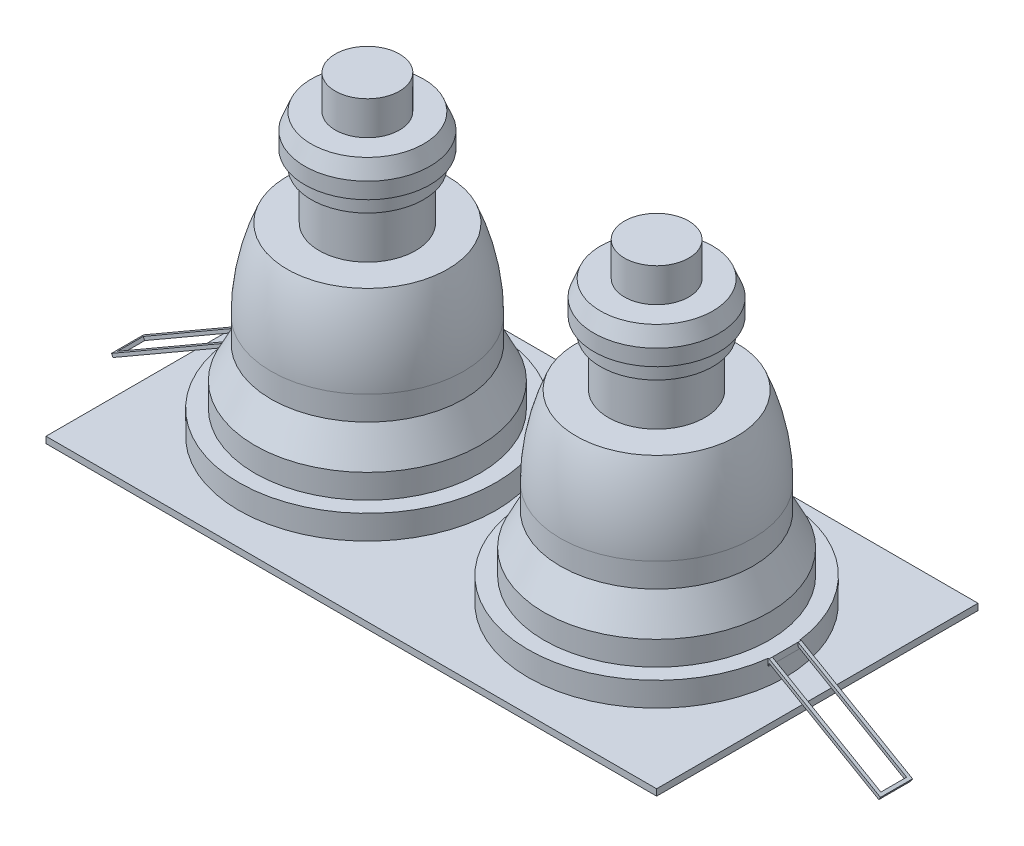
SolidWorks part; units mm, degrees
ref_plane "Alzado" through (0, 0, 0) normal (0, 0, 1) x (1, 0, 0)
ref_plane "Planta" through (0, 0, 0) normal (0, 1, 0) x (1, 0, 0)
ref_plane "Vista lateral" through (0, 0, 0) normal (1, 0, 0) x (0, 0, -1)
sketch "Croquis1" plane through (0, 0, 0) normal (0, 1, 0) x (1, 0, 0)
  line L3 (-50, -50) -> (50, -50)
  line L4 (-50, -50) -> (-50, 50)
  line L5 (-50, 50) -> (50, 50)
  line L6 (50, -50) -> (50, 50)
  point P4 (0, 0)
  point P8 (0, 0)
  dimension "D1" = 50
  dimension "D2" = 100
  dimension "D3" = 50
extrude "Saliente-Extruir1" add sketch "Croquis1" along normal blind 2
sketch "Croquis2" plane through (0, 0, 0) normal (0, 0, 1) x (1, 0, 0)
  line L0 (0, 0) -> (0, 100) construction
  line L1 (0, 2) -> (-40, 2)
  line L2 (-50, 2) -> (50, 2) construction
  line L3 (-40, 2) -> (-40, 9.5)
  line L4 (-40, 9.5) -> (-35, 9.5)
  line L6 (-40, 9.5) -> (-35, 9.5)
  line L7 (-35, 9.5) -> (-35, 17)
  line L8 (-30, 27) -> (-30, 34.5)
  line L9 (0, 17) -> (0, 2)
  line L10 (0, 17) -> (0, 27)
  line L11 (0, 34.5) -> (0, 59.5)
  line L12 (-30, 27) -> (-35, 17)
  line L14 (0, 34.5) -> (0, 27)
  line L15 (-15, 59.5) -> (-25, 59.5)
  line L16 (-15, 59.5) -> (-15, 74.5)
  line L17 (-15, 74.5) -> (-17.5, 74.5)
  line L18 (-17.5, 74.5) -> (-17.5, 79.5)
  line L19 (-17.5, 79.5) -> (-19.5, 79.5)
  line L20 (-19.5, 79.5) -> (-19.5, 84.5)
  line L22 (0, 84.5) -> (0, 59.5)
  line L23 (0, 84.5) -> (0, 89.5)
  line L24 (-10, 89.5) -> (-17.5, 89.5)
  line L25 (-17.5, 89.5) -> (-19.5, 84.5)
  line L27 (-10, 89.5) -> (-10, 100)
  line L28 (-10, 100) -> (0, 100)
  line L29 (0, 100) -> (0, 89.5)
  arc A0 (-25, 59.5) -> (-30, 34.5) centre (35, 34.5) ccw
  dimension "D10" = 65
  dimension "D1" = 7.5
  dimension "D2" = 7.5
  dimension "D3" = 40
  dimension "D4" = 35
  dimension "D5" = 30
  dimension "D6" = 10
  dimension "D7" = 30
  dimension "D8" = 30
  dimension "D9" = 25
  dimension "D11" = 57.5
revolve "Revolución1" add sketch "Croquis2" angle 360 about L0
ref_plane "Plano1" through (40, 0, 0) normal (1, 0, 0) x (0, 0, -1)
sketch "Croquis3" plane through (40, 0, 0) normal (1, 0, 0) x (0, 0, -1)
  line L0 (5, 9.5) -> (-5, 9.5)
  line L1 (40, 9.5) -> (-40, 9.5) construction
  line L2 (-5, 9.5) -> (-5, 7.5)
  line L3 (-5, 7.5) -> (5, 7.5)
  line L4 (5, 7.5) -> (5, 9.5)
  point P5 (0, 9.5)
extrude "Saliente-Extruir2" add sketch "Croquis3" against normal up to next
ref_plane "Plano2" through (14.1136, 24.4455, 0) normal (0.5, 0.866, 0) x (0, 0, 1)
sketch "Croquis4" plane through (14.1136, 24.4455, 0) normal (0.5, 0.866, 0) x (0, 0, 1)
  line L0 (-5, 29.891) -> (-5, 69.891)
  line L1 (-5, 69.891) -> (5, 69.891)
  line L2 (5, 69.891) -> (5, 29.891)
  line L3 (-4, 29.891) -> (-4, 68.891)
  line L4 (-4, 68.891) -> (4, 68.891)
  line L5 (4, 68.891) -> (4, 29.891)
  line L6 (-5, 29.891) -> (-4, 29.891)
  line L7 (-5, 29.891) -> (5, 29.891) construction
  line L8 (4, 29.891) -> (5, 29.891)
  dimension "D1" = 1
extrude "Saliente-Extruir3" add sketch "Croquis4" against normal blind 1
sketch "Croquis5" plane through (0, 0, 0) normal (0, -1, 0) x (1, 0, 0)
  circle A0 centre (0, 0) radius 30
ref_plane "Plano3" through (0, 20, 0) normal (0, -1, 0) x (-1, 0, 0)
sketch "Croquis6" plane through (0, 20, 0) normal (0, -1, 0) x (-1, 0, 0)
  circle A2 centre (0, 0) radius 20
  circle A3 centre (0, 0) radius 20
  dimension "D1" = 10
loft "Cortar-Recubrir1" cut profiles "Croquis6", "Croquis5"
sketch "Croquis7" plane through (0, 0, 0) normal (0, -1, 0) x (1, 0, 0)
  line L8 (-40, 40) -> (-40, -40)
  line L9 (-40, -40) -> (40, -40)
  line L10 (40, -40) -> (40, 40)
  line L11 (40, 40) -> (-40, 40)
  line L12 (-40, 40) -> (-40, -40)
  line L13 (-40, -40) -> (40, -40)
  line L14 (40, -40) -> (40, 40)
  line L15 (40, 40) -> (-40, 40)
  dimension "D1" = 10
extrude "Cortar-Extruir2" cut sketch "Croquis7" against normal blind 1
ref_plane "Plano4" through (-45, 0, 0) normal (-1, 0, 0) x (0, 0, 1)
mirror "Simetría4" about plane through (-45, 0, 0) normal (-1, 0, 0) of "Saliente-Extruir3", "Saliente-Extruir2", "Cortar-Recubrir1", "Cortar-Extruir2", "Revolución1", "Saliente-Extruir1"
